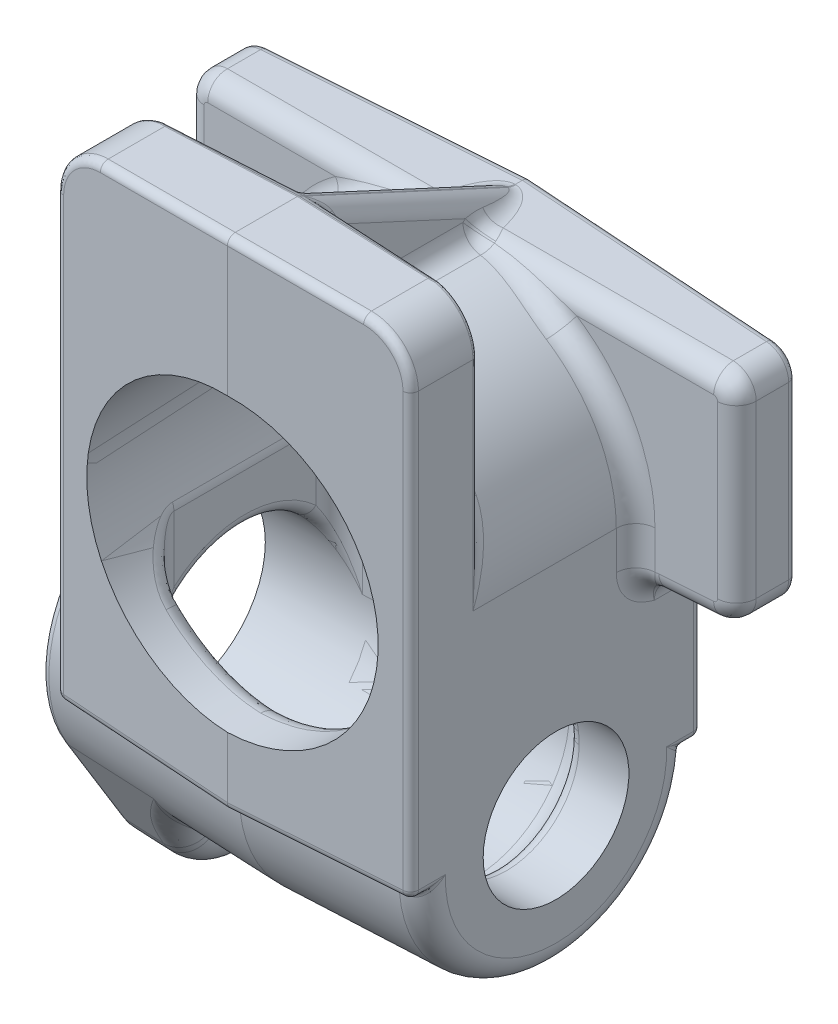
SolidWorks part; units mm, degrees
ref_plane "Plan de face" through (0, 0, 0) normal (0, 0, 1) x (1, 0, 0)
ref_plane "Plan de dessus" through (0, 0, 0) normal (0, 1, 0) x (1, 0, 0)
ref_plane "Plan de droite" through (0, 0, 0) normal (1, 0, 0) x (0, 0, -1)
inserted part "GBrut+congé+dep<1>@Assemblage-Brut"
ref_plane "Plan4" through (0, -85, 0) normal (0, 1, 0) x (-1, 0, 0)
sketch "Esquisse1" plane through (0, -85, 0) normal (0, 1, 0) x (-1, 0, 0)
  line L0 (0, 2.2018) -> (0, -68.2018) construction
  circle A0 centre (0, -33) radius 10
  dimension "D1" = 20
extrude "Extrusion1" add sketch "Esquisse1" against normal blind 8
sketch "Esquisse3" plane through (0, 0, 0) normal (0, 0, 1) x (1, 0, 0)
  line L0 (-13.6855, -90.5221) -> (0, -91)
  line L1 (0, -91) -> (13.8983, -90.5147)
  line L2 (0, -85.5045) -> (0, -55.6405) construction
  dimension "D1" = 91
  dimension "D2" = 88
  dimension "D3" = 88
extrude "Enlèv. mat.-Extru.1" cut sketch "Esquisse3" against normal through all and the other way through all flip side to cut
fillet "Congé1" radius 3 2 edges at (9.9577, -86.5847, -33.9187) (-9.9577, -86.5847, -32.0813)
fillet "Congé2" radius 1 2 edges at (-10, -90.6508, -33) (10, -90.6508, -33)
fillet "Congé4" radius 5 10 edges at (28.7902, -20.72, -54.7713) (30, -21.1564, -32.9802) (28.5702, -23.0106, -10.9541) (12.9175, -34.1719, -8.4511) (-32.7304, -13.8041, -54.7095) (-34, -14.0945, -32.9915) (-15.5425, -33.0772, -8.5428) (-33.6954, -14.7846, -13.0941)
fillet "Congé5" radius 3 4 edges at (30, -49.722, -14.5856) (30, -33, -33) (30, -49.722, -51.4144) (30, -70, -33)
fillet "Congé6" radius 3 5 edges at (-33.3415, -39.773, -12.2487) (-33.3415, -39.773, -53.7513) (-34, -27.6873, -33) (-20, 0.5, -57.3016) (20, 0.5, -57.3016)
scale "Echelle1" scale about centroid uniform scaling yes scale factor 1.010101
surface "Surface-Cousue1"
